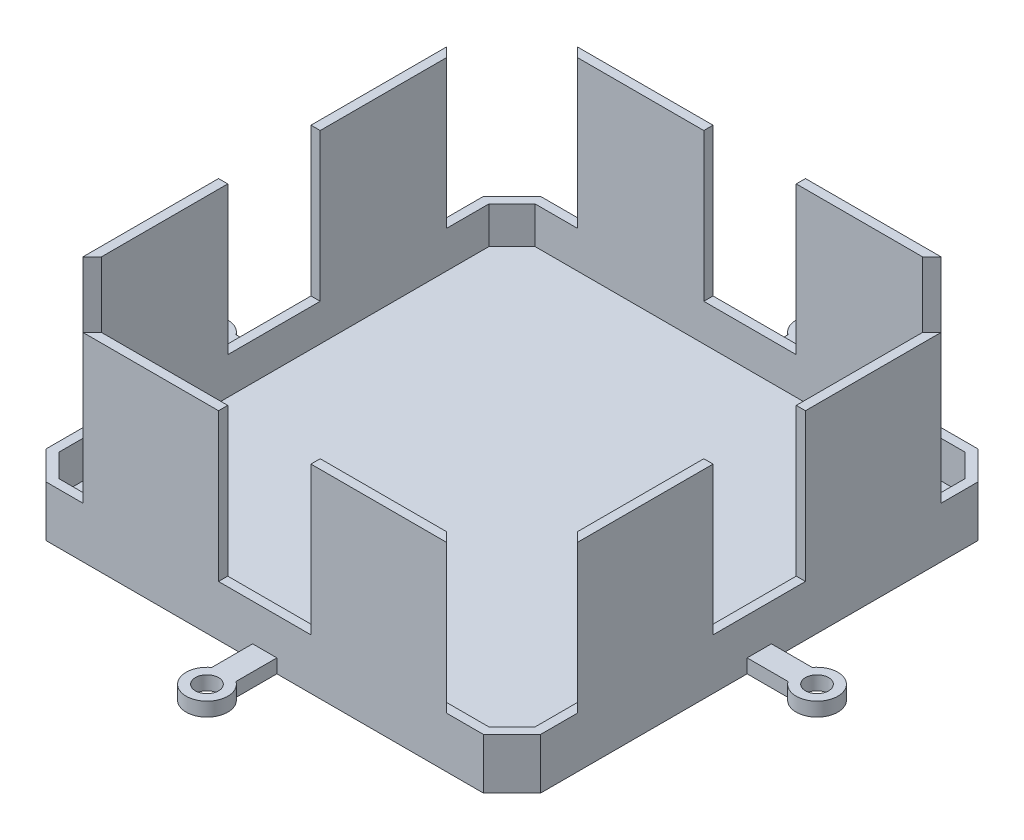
SolidWorks part; units mm, degrees
ref_plane "Front Plane" through (0, 0, 0) normal (0, 0, 1) x (1, 0, 0)
ref_plane "Top Plane" through (0, 0, 0) normal (0, 1, 0) x (1, 0, 0)
ref_plane "Right Plane" through (0, 0, 0) normal (1, 0, 0) x (0, 0, -1)
sketch "Sketch1" plane through (0, 0, 0) normal (0, 1, 0) x (1, 0, 0)
  line L0 (46.5, 51.5) -> (51.5, 46.5)
  line L1 (-46.5, -51.5) -> (46.5, -51.5)
  line L2 (-51.5, -46.5) -> (-51.5, 46.5)
  line L3 (-46.5, 51.5) -> (46.5, 51.5)
  line L4 (51.5, -46.5) -> (51.5, 46.5)
  line L5 (-51.5, -51.5) -> (51.5, 51.5) construction
  line L6 (-51.5, 51.5) -> (51.5, -51.5) construction
  line L7 (-51.5, 46.5) -> (-46.5, 51.5)
  line L8 (-51.5, -46.5) -> (-46.5, -51.5)
  line L9 (46.5, -51.5) -> (51.5, -46.5)
  line L10 (-53.5, -47.3284) -> (-53.5, 47.3284)
  line L11 (-53.5, 47.3284) -> (-47.3284, 53.5)
  line L12 (-47.3284, 53.5) -> (47.3284, 53.5)
  line L13 (47.3284, 53.5) -> (53.5, 47.3284)
  line L14 (53.5, -47.3284) -> (53.5, 47.3284)
  line L15 (47.3284, -53.5) -> (53.5, -47.3284)
  line L16 (-47.3284, -53.5) -> (47.3284, -53.5)
  line L17 (-53.5, -47.3284) -> (-47.3284, -53.5)
  point P0 (0, 0)
  dimension "D1" = 103
  dimension "D2" = 103
  dimension "D3" = 2
extrude "Extruded Walls" add sketch "Sketch1" along normal blind 43
sketch "Sketch2" plane through (0, 0, 0) normal (0, -1, 0) x (1, 0, 0)
  line L0 (46.5, 51.5) -> (51.5, 46.5) construction
  line L1 (51.5, -46.5) -> (46.5, -51.5) construction
  line L2 (51.5, 46.5) -> (51.5, -46.5) construction
  line L3 (46.5, -51.5) -> (-46.5, -51.5) construction
  line L4 (-46.5, -51.5) -> (-51.5, -46.5) construction
  line L5 (-46.5, 51.5) -> (46.5, 51.5) construction
  line L6 (-51.5, 46.5) -> (-46.5, 51.5) construction
  line L7 (-51.5, -46.5) -> (-51.5, 46.5) construction
  line L8 (46.5, 51.5) -> (51.5, 46.5)
  line L9 (51.5, -46.5) -> (46.5, -51.5)
  line L10 (51.5, 46.5) -> (51.5, -46.5)
  line L11 (46.5, -51.5) -> (-46.5, -51.5)
  line L12 (-46.5, -51.5) -> (-51.5, -46.5)
  line L13 (-46.5, 51.5) -> (46.5, 51.5)
  line L14 (-51.5, 46.5) -> (-46.5, 51.5)
  line L15 (-51.5, -46.5) -> (-51.5, 46.5)
  line L16 (0, 0) -> (70.6151, 0) construction
  line L17 (53.5, 2.625) -> (53.5, -2.625)
  line L18 (53.5, 47.3284) -> (53.5, -47.3284) construction
  line L19 (53.5, 2.625) -> (62.345, 2.625)
  line L20 (53.5, -2.625) -> (62.345, -2.625)
  line L21 (2.625, -53.5) -> (-2.625, -53.5)
  line L22 (2.625, -53.5) -> (2.625, -62.345)
  line L23 (-2.625, -53.5) -> (-2.625, -62.345)
  line L24 (0, 0) -> (0, -70.6151) construction
  line L25 (-53.5, -2.625) -> (-53.5, 2.625)
  line L26 (-53.5, -2.625) -> (-62.345, -2.625)
  line L27 (-53.5, 2.625) -> (-62.345, 2.625)
  line L28 (0, 0) -> (-70.6151, 0) construction
  line L29 (-2.625, 53.5) -> (2.625, 53.5)
  line L30 (-2.625, 53.5) -> (-2.625, 62.345)
  line L31 (2.625, 53.5) -> (2.625, 62.345)
  line L32 (0, 0) -> (0, 70.6151) construction
  circle A0 centre (66, 0) radius 2.5
  arc A1 (62.345, -2.625) -> (62.345, 2.625) centre (66, 0) ccw
  circle A2 centre (0, -66) radius 2.5
  arc A3 (-2.625, -62.345) -> (2.625, -62.345) centre (0, -66) ccw
  circle A4 centre (-66, 0) radius 2.5
  arc A5 (-62.345, 2.625) -> (-62.345, -2.625) centre (-66, 0) ccw
  circle A6 centre (0, 66) radius 2.5
  arc A7 (2.625, 62.345) -> (-2.625, 62.345) centre (0, 66) ccw
  point P11 (53.5, 0)
  point P44 (0, 0)
  dimension "D1" = 12.5
  dimension "D2" = 5
  dimension "D3" = 9
  dimension "D4" = 8.845
  dimension "D5" = 4
extrude "Extruded Bottom" add sketch "Sketch2" against normal blind 3
sketch "Sketch3" plane through (0, 43, 0) normal (0, 1, 0) x (1, 0, 0)
  line L0 (0, 0) -> (78.8263, 0) construction
  line L1 (50, -10) -> (50, 10)
  line L2 (50, 10) -> (73, 10)
  line L3 (73, 10) -> (73, -10)
  line L4 (73, -10) -> (50, -10)
  line L5 (44.5477, -58.6899) -> (28.2843, -42.4264)
  line L6 (28.2843, -42.4264) -> (42.4264, -28.2843)
  line L7 (42.4264, -28.2843) -> (58.6899, -44.5477)
  line L8 (58.6899, -44.5477) -> (44.5477, -58.6899)
  line L9 (-10, -73) -> (-10, -50)
  line L10 (-10, -50) -> (10, -50)
  line L11 (10, -50) -> (10, -73)
  line L12 (10, -73) -> (-10, -73)
  line L13 (-58.6899, -44.5477) -> (-42.4264, -28.2843)
  line L14 (-42.4264, -28.2843) -> (-28.2843, -42.4264)
  line L15 (-28.2843, -42.4264) -> (-44.5477, -58.6899)
  line L16 (-44.5477, -58.6899) -> (-58.6899, -44.5477)
  line L17 (-73, 10) -> (-50, 10)
  line L18 (-50, 10) -> (-50, -10)
  line L19 (-50, -10) -> (-73, -10)
  line L20 (-73, -10) -> (-73, 10)
  line L21 (-44.5477, 58.6899) -> (-28.2843, 42.4264)
  line L22 (-28.2843, 42.4264) -> (-42.4264, 28.2843)
  line L23 (-42.4264, 28.2843) -> (-58.6899, 44.5477)
  line L24 (-58.6899, 44.5477) -> (-44.5477, 58.6899)
  line L25 (10, 73) -> (10, 50)
  line L26 (10, 50) -> (-10, 50)
  line L27 (-10, 50) -> (-10, 73)
  line L28 (-10, 73) -> (10, 73)
  line L29 (58.6899, 44.5477) -> (42.4264, 28.2843)
  line L30 (42.4264, 28.2843) -> (28.2843, 42.4264)
  line L31 (28.2843, 42.4264) -> (44.5477, 58.6899)
  line L32 (44.5477, 58.6899) -> (58.6899, 44.5477)
  point P7 (50, 0)
  point P39 (0, 0)
  dimension "D1" = 20
  dimension "D2" = 23
  dimension "D3" = 50
  dimension "D5" = 50
  dimension "D6" = 50
  dimension "D4" = 8
extrude "Cut-Extrude1" cut sketch "Sketch3" against normal blind 32
